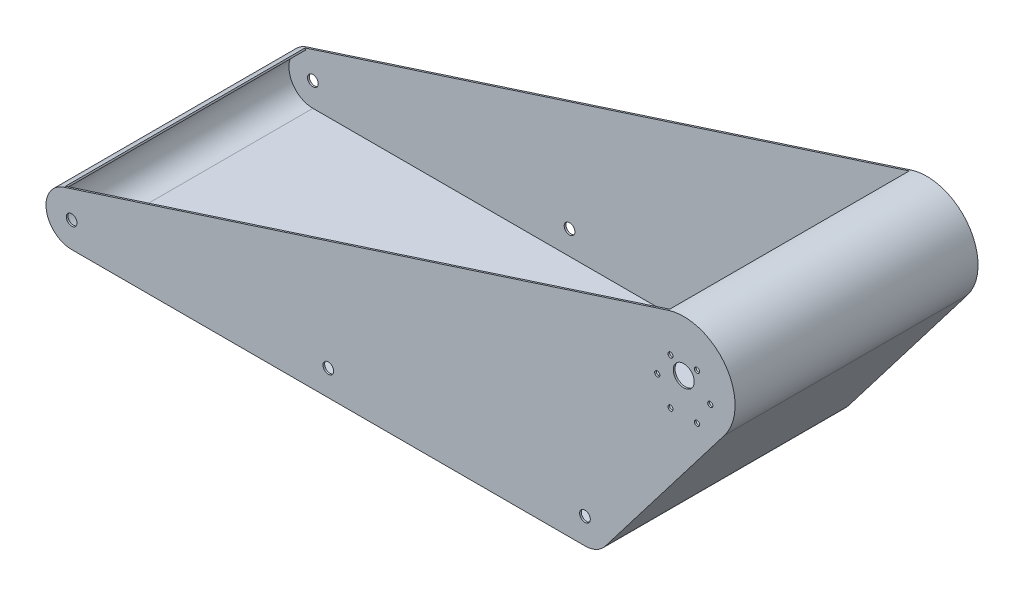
SolidWorks part; units mm, degrees
ref_plane "Front Plane" through (0, 0, 0) normal (0, 0, 1) x (1, 0, 0)
ref_plane "Top Plane" through (0, 0, 0) normal (0, 1, 0) x (1, 0, 0)
ref_plane "Right Plane" through (0, 0, 0) normal (1, 0, 0) x (0, 0, -1)
other "Center of Mass"
sketch "Sketch1" plane through (0, 0, 0) normal (0, 0, 1) x (1, 0, 0)
  line L7 (0, -15) -> (300, -15)
  line L8 (348.5118, 128.5681) -> (-4.6191, 14.2711)
  line L10 (311.9063, -9.1235) -> (381.5627, 81.7788)
  arc A3 (-4.6191, 14.2711) -> (0, -15) centre (0, 0) ccw
  arc A4 (381.5627, 81.7788) -> (348.5118, 128.5681) centre (357.75, 100.0259) ccw
  arc A5 (300, -15) -> (311.9063, -9.1235) centre (300, 0) ccw
  dimension "D4" = 15
  dimension "D5" = 30
  dimension "D6" = 15
  dimension "D1" = 371.1674
  dimension "D2" = 300
  dimension "D3" = 114.5218
extrude "Boss-Extrude1" add sketch "Sketch1" along normal blind 1
sketch "Sketch2" plane through (0, 0, 1) normal (0, 0, 1) x (1, 0, 0)
  line L2 (-4.6191, 14.2711) -> (-4.3111, 13.3197)
  line L3 (0, -14) -> (300, -14)
  line L4 (0, -14) -> (300, -14)
  line L9 (311.9063, -9.1235) -> (381.5627, 81.7788) construction
  line L10 (311.9063, -9.1235) -> (381.5627, 81.7788)
  line L11 (311.1126, -8.5153) -> (380.7689, 82.3871)
  line L12 (348.5118, 128.5681) -> (348.8198, 127.6167)
  line L13 (0, -15) -> (300, -15) construction
  line L14 (0, -15) -> (300, -15)
  arc A5 (381.5627, 81.7788) -> (348.5118, 128.5681) centre (357.75, 100.0259) ccw
  arc A11 (300, -14) -> (311.1126, -8.5153) centre (300, 0) ccw
  arc A12 (-4.3111, 13.3197) -> (0, -14) centre (0, 0) ccw
  arc A13 (300, -14) -> (311.1126, -8.5153) centre (300, 0) ccw
  arc A14 (-4.3111, 13.3197) -> (0, -14) centre (0, 0) ccw
  arc A15 (380.7689, 82.3871) -> (348.8198, 127.6167) centre (357.75, 100.0259) ccw
  arc A16 (-4.6191, 14.2711) -> (0, -15) centre (0, 0) ccw construction
  arc A17 (-4.6191, 14.2711) -> (0, -15) centre (0, 0) ccw
  arc A18 (300, -15) -> (311.9063, -9.1235) centre (300, 0) ccw construction
  arc A19 (300, -15) -> (311.9063, -9.1235) centre (300, 0) ccw
  dimension "D1" = 1
extrude "Boss-Extrude2" add sketch "Sketch2" along normal blind 140
sketch "Sketch3" plane through (0, 0, 141) normal (0, 0, 1) x (1, 0, 0)
  line L0 (311.9063, -9.1235) -> (381.5627, 81.7788) construction
  line L1 (0, -15) -> (300, -15) construction
  line L2 (311.9063, -9.1235) -> (381.5627, 81.7788)
  line L3 (0, -15) -> (300, -15)
  line L4 (-4.6191, 14.2711) -> (348.5118, 128.5681)
  arc A0 (381.5627, 81.7788) -> (348.5118, 128.5681) centre (357.75, 100.0259) ccw construction
  arc A1 (300, -15) -> (311.9063, -9.1235) centre (300, 0) ccw construction
  arc A2 (-4.6191, 14.2711) -> (0, -15) centre (0, 0) ccw construction
  arc A3 (381.5627, 81.7788) -> (348.5118, 128.5681) centre (357.75, 100.0259) ccw
  arc A4 (300, -15) -> (311.9063, -9.1235) centre (300, 0) ccw
  arc A5 (-4.6191, 14.2711) -> (0, -15) centre (0, 0) ccw
extrude "Boss-Extrude3" add sketch "Sketch3" along normal blind 1
sketch "Sketch4" plane through (0, 0, 142) normal (0, 0, 1) x (1, 0, 0)
  circle A0 centre (0, 0) radius 3.125
  circle A2 centre (300, 0) radius 3.125
  circle A3 centre (357.75, 100.0259) radius 6.125
  circle A4 centre (150, 0) radius 3.125
  arc A26 (367, 106.6668) -> (364, 106.6668) centre (365.5, 106.6668) ccw
  arc A27 (364, 106.6668) -> (367, 106.6668) centre (365.5, 106.6668) ccw
  arc A28 (374.75, 93.2434) -> (371.75, 93.2434) centre (373.25, 93.2434) ccw
  arc A29 (371.75, 93.2434) -> (374.75, 93.2434) centre (373.25, 93.2434) ccw
  arc A30 (367, 79.82) -> (364, 79.82) centre (365.5, 79.82) ccw
  arc A31 (364, 79.82) -> (367, 79.82) centre (365.5, 79.82) ccw
  arc A32 (351.5, 79.82) -> (348.5, 79.82) centre (350, 79.82) ccw
  arc A33 (348.5, 79.82) -> (351.5, 79.82) centre (350, 79.82) ccw
  arc A34 (343.75, 93.2434) -> (340.75, 93.2434) centre (342.25, 93.2434) ccw
  arc A35 (340.75, 93.2434) -> (343.75, 93.2434) centre (342.25, 93.2434) ccw
  arc A36 (351.5, 106.6668) -> (348.5, 106.6668) centre (350, 106.6668) ccw
  arc A37 (348.5, 106.6668) -> (351.5, 106.6668) centre (350, 106.6668) ccw
  dimension "D2" = 6.25
  dimension "D3" = 12.25
  dimension "D4" = 6.25
extrude "Cut-Extrude2" cut sketch "Sketch4" against normal up to surface (142 mm away)
ref_plane "mirror plane " through (0, 0, 71) normal (0, 0, -1) x (-1, 0, 0)
